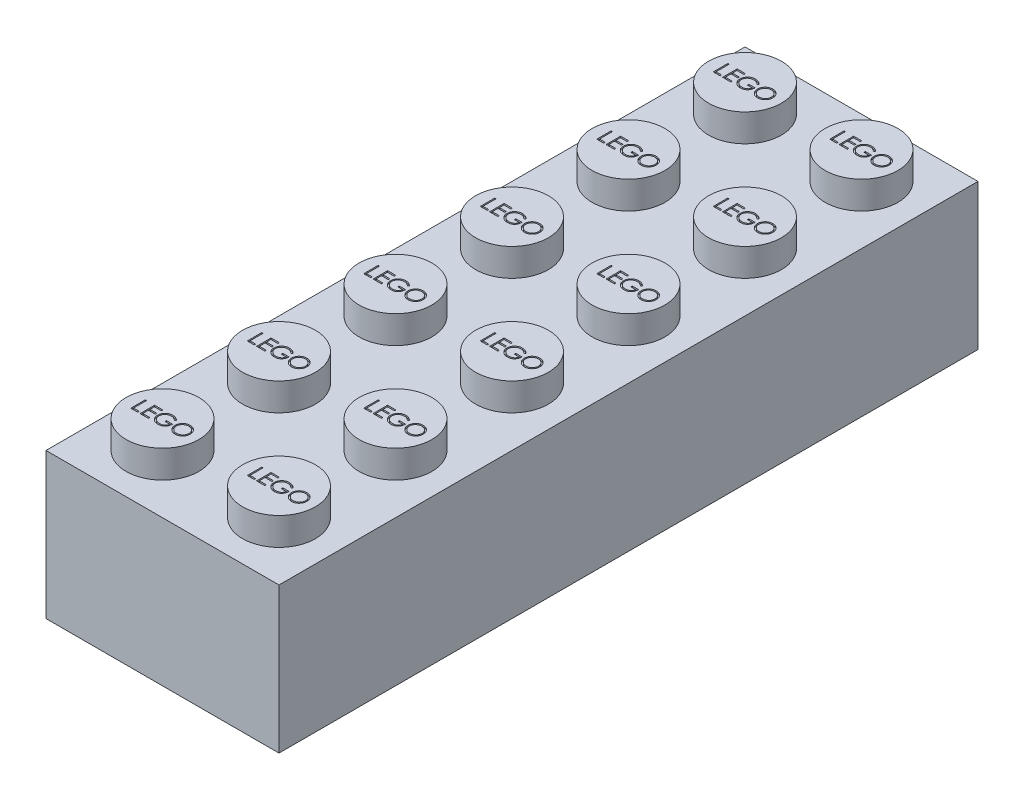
SolidWorks part; units mm, degrees
ref_plane "Plano frontal" through (0, 0, 0) normal (0, 0, 1) x (1, 0, 0)
ref_plane "Plano superior" through (0, 0, 0) normal (0, 1, 0) x (1, 0, 0)
ref_plane "Plano direito" through (0, 0, 0) normal (1, 0, 0) x (0, 0, -1)
sketch "Esboço1" plane through (0, 0, 0) normal (0, 1, 0) x (1, 0, 0)
  line L1 (0, 0) -> (16, 0)
  line L2 (0, 0) -> (0, 16)
  line L3 (0, 16) -> (16, 16)
  line L4 (16, 0) -> (16, 16)
  dimension "D1" = 16
  dimension "D2" = 16
extrude "Ressalto-extrusão1" add sketch "Esboço1" along normal blind 10
sketch "Esboço2" plane through (0, 10, 0) normal (0, 1, 0) x (1, 0, 0)
  line L0 (0, 0) -> (16, 0) construction
  line L1 (16, 0) -> (16, 16) construction
  circle A0 centre (4, 4) radius 2.5
  circle A1 centre (4, 12) radius 2.5
  circle A2 centre (12, 12) radius 2.5
  circle A3 centre (12, 4) radius 2.5
  dimension "D1" = 5
  dimension "D2" = 5
  dimension "D3" = 5
  dimension "D4" = 5
  dimension "D5" = 8
  dimension "D6" = 8
  dimension "D7" = 8
  dimension "D8" = 8
  dimension "D9" = 4
  dimension "D10" = 4
  dimension "D11" = 8
extrude "Ressalto-extrusão2" add sketch "Esboço2" along normal blind 1.9
sketch "Esboço3" plane through (0, 0, 0) normal (0, -1, 0) x (1, 0, 0)
  line L0 (0, 0) -> (16, 0) construction
  line L1 (1, -1) -> (15, -1)
  line L2 (1, -1) -> (1, -15)
  line L3 (1, -15) -> (15, -15)
  line L4 (15, -1) -> (15, -15)
  line L5 (16, -16) -> (0, -16) construction
  line L6 (16, 0) -> (16, -16) construction
  line L7 (0, -16) -> (0, 0) construction
  circle A0 centre (8, -8) radius 3.5
  circle A1 centre (8, -8) radius 2.5
  dimension "D5" = 7
  dimension "D6" = 5
  dimension "D1" = 1
  dimension "D2" = 1
  dimension "D3" = 1
  dimension "D4" = 1
extrude "Corte-extrusão1" cut sketch "Esboço3" against normal blind 9 contours L4 L1 L2 L3 A0 | A1
sketch "Esboço6" plane through (0, 11.9, 0) normal (0, 1, 0) x (1, 0, 0)
  text T0 "LEGO" font "Century Gothic" height 1
extrude "Corte-extrusão2" cut sketch "Esboço6" against normal blind 0.1
pattern_linear "Padrão linear1" count 2 spacing 8 along (0, 0, -1) of "Corte-extrusão2"
pattern_linear "Padrão linear2" count 2 spacing 8 along (1, 0, 0) of "Padrão linear1", "Corte-extrusão2"
pattern_linear "Padrão linear3" count 3 spacing 16 along (0, 0, -1) of "Ressalto-extrusão1", "Ressalto-extrusão2", "Corte-extrusão1", "Corte-extrusão2", "Padrão linear1", "Padrão linear2"
sketch "Esboço7" plane through (0, 0, 0) normal (0, -1, 0) x (1, 0, 0)
  line L1 (1, -15) -> (15, -15)
  line L2 (1, -15) -> (1, -17)
  line L3 (1, -17) -> (15, -17)
  line L4 (15, -15) -> (15, -17)
  line L5 (1, -31) -> (15, -31)
  line L6 (1, -31) -> (1, -33)
  line L7 (1, -33) -> (15, -33)
  line L8 (15, -31) -> (15, -33)
extrude "Corte-extrusão3" cut sketch "Esboço7" against normal up to surface (9 mm away)
